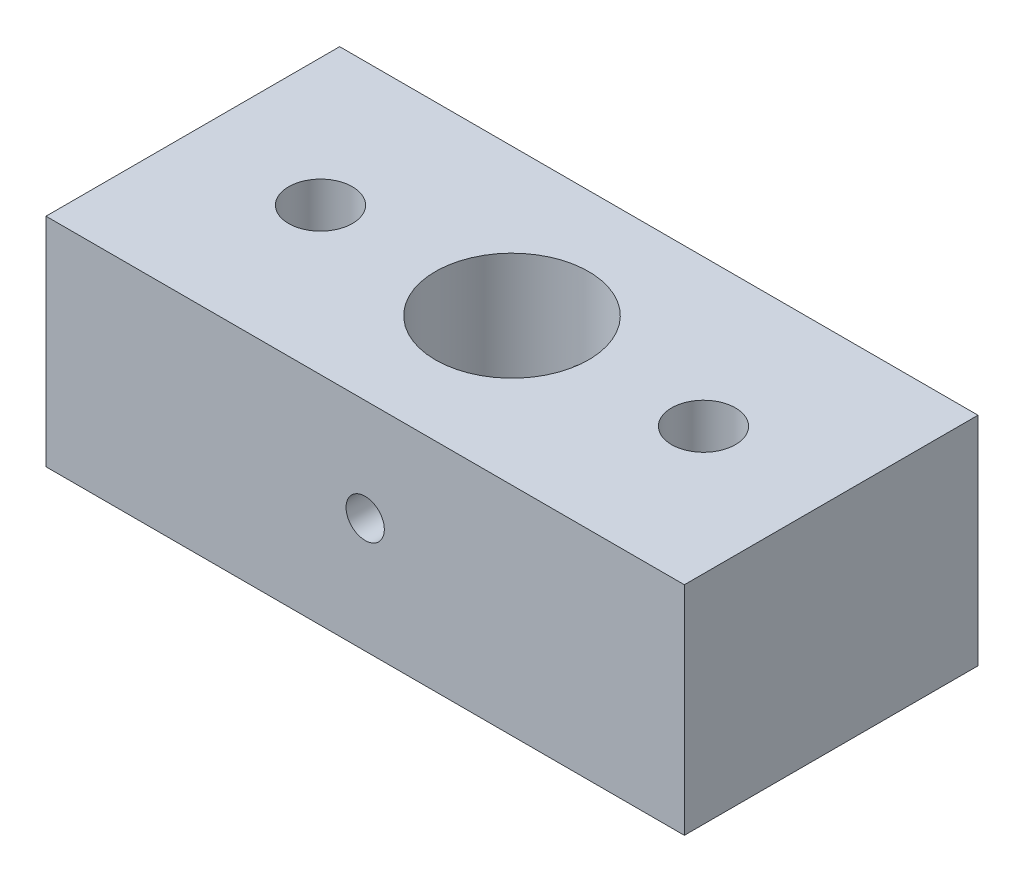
SolidWorks part; units mm, degrees
ref_plane "Face" through (0, 0, 0) normal (0, 0, 1) x (1, 0, 0)
ref_plane "Dessus" through (0, 0, 0) normal (0, 1, 0) x (1, 0, 0)
ref_plane "Droite" through (0, 0, 0) normal (1, 0, 0) x (0, 0, -1)
sketch "Esquisse1" plane through (0, 0, 0) normal (0, 0, 1) x (1, 0, 0)
  line L1 (7.4139, -6.4273) -> (57.4139, -6.4273)
  line L2 (7.4139, -6.4273) -> (7.4139, -23.4273)
  line L3 (7.4139, -23.4273) -> (57.4139, -23.4273)
  line L4 (57.4139, -6.4273) -> (57.4139, -23.4273)
  dimension "D1" = 17
  dimension "D2" = 50
extrude "Base-Extrusion" add sketch "Esquisse1" along normal blind 23
sketch "Esquisse2" plane through (0, -6.4273, 0) normal (0, 1, 0) x (-1, 0, 0)
  line L0 (-57.4139, 23) -> (-7.4139, 23) construction
  line L1 (-57.4139, 23) -> (-57.4139, 0) construction
  circle A0 centre (-32.4139, 11.5) radius 6
  dimension "D1" = 12
  dimension "D2" = 11.5
  dimension "D3" = 25
extrude "Enlèv. mat.-Extru.1" cut sketch "Esquisse2" against normal blind 23
hole_wizard "Trou taraudé M6x1.01" positions "Esquisse4" profile "Esquisse3" tap size "M6x1.0" standard "ISO"
sketch "Esquisse4" plane through (0, -6.4273, 0) normal (0, 1, 0) x (-1, 0, 0)
  line L0 (-57.4139, 23) -> (-7.4139, 23) construction
  circle A0 centre (-32.4139, 11.5) radius 6 construction
  point P0 (-47.4139, 11.5)
  point P1 (-17.4139, 11.5)
  dimension "D2" = 15
  dimension "D1" = 15
  dimension "D3" = 11.5
  dimension "D4" = 11.5
sketch "Esquisse3" plane through (47.4139, -6.4273, 11.5) normal (1, 0, 0) x (0, 0, 1)
  line L0 (0, 0) -> (0, 17)
  line L1 (0, 17) -> (2.5, 17)
  line L2 (2.5, 17) -> (2.5, 0)
  line L5 (2.5, 0) -> (0, 0)
  line L11 (0, -6.35) -> (0, 107.95) construction
  dimension "Diamètre du perçage jusqu'au prochain" = 5
  dimension "Profondeur du perçage jusqu'au prochain" = 17
sketch "Esquisse5" plane through (0, 0, 23) normal (0, 0, 1) x (1, 0, 0)
  line L0 (32.4139, -23.4273) -> (32.4139, -6.4273) construction
  line L1 (57.4139, -6.4273) -> (7.4139, -6.4273) construction
  circle A0 centre (32.4139, -14.4273) radius 1.5
  dimension "D1" = 3
  dimension "D2" = 8
extrude "Enlèv. mat.-Extru.2" cut sketch "Esquisse5" against normal blind 23
